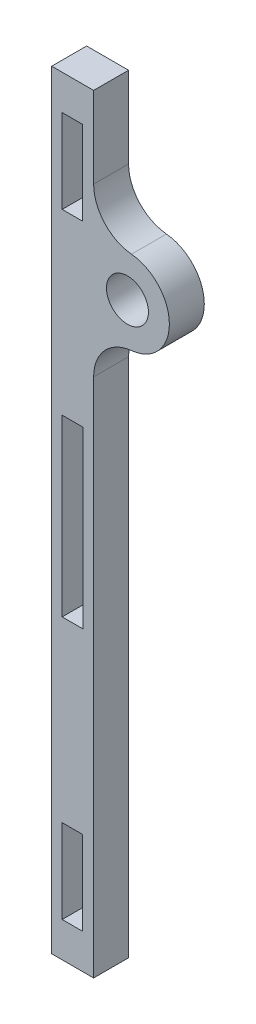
SolidWorks part; units mm, degrees
ref_plane "Ebene vorne" through (0, 0, 0) normal (0, 0, 1) x (1, 0, 0)
ref_plane "Ebene oben" through (0, 0, 0) normal (0, 1, 0) x (1, 0, 0)
ref_plane "Ebene rechts" through (0, 0, 0) normal (1, 0, 0) x (0, 0, -1)
sketch "Skizze1" plane through (0, 0, 0) normal (0, 0, 1) x (1, 0, 0)
  line L0 (-219.0998, -16.4582) -> (-219.0998, -90.9517)
  line L1 (-225.0998, 19.0483) -> (-219.0998, 19.0483)
  line L2 (-225.0998, 19.0483) -> (-225.0998, -90.9517)
  line L3 (-225.0998, -90.9517) -> (-219.0998, -90.9517)
  line L4 (-219.0998, 19.0483) -> (-219.0998, 7.4292)
  line L5 (-223.5998, 14.0483) -> (-220.6998, 14.0483)
  line L6 (-223.5998, 14.0483) -> (-223.5998, 2.0483)
  line L7 (-223.5998, 2.0483) -> (-220.6998, 2.0483)
  line L8 (-220.6998, 14.0483) -> (-220.6998, 2.0483)
  line L9 (-223.5998, -73.9517) -> (-220.6998, -73.9517)
  line L10 (-223.5998, -73.9517) -> (-223.5998, -85.9517)
  line L11 (-223.5998, -85.9517) -> (-220.6998, -85.9517)
  line L12 (-220.6998, -73.9517) -> (-220.6998, -85.9517)
  line L17 (-223.5998, -23.4517) -> (-223.5998, -48.4517)
  line L18 (-223.5998, -48.4517) -> (-220.5998, -48.4517)
  line L19 (-220.5998, -48.4517) -> (-220.5998, -23.4517)
  line L20 (-220.5998, -23.4517) -> (-223.5998, -23.4517)
  line L21 (-223.5998, -23.4517) -> (-223.5998, -48.4517)
  line L22 (-223.5998, -48.4517) -> (-220.5998, -48.4517)
  line L23 (-220.5998, -48.4517) -> (-220.5998, -23.4517)
  line L24 (-220.5998, -23.4517) -> (-223.5998, -23.4517)
  circle A0 centre (-214.2609, -4.5145) radius 3
  arc A1 (-213.6803, -10.4864) -> (-213.6803, 1.4573) centre (-214.2609, -4.5145) ccw
  circle A2 centre (-214.2609, -4.5145) radius 6 construction
  arc A3 (-213.6803, -10.4864) -> (-219.0998, -16.4582) centre (-213.0998, -16.4582) ccw
  arc A4 (-213.6803, 1.4573) -> (-219.0998, 7.4292) centre (-213.0998, 7.4292) cw
  point P16 (-214.2609, -4.5145)
  dimension "D9" = 6
  dimension "D10" = 6
  dimension "D1" = 110
  dimension "D2" = 6
  dimension "D3" = 12
  dimension "D4" = 2.9
  dimension "D5" = 1.5
  dimension "D6" = 100
  dimension "D7" = 5
  dimension "D8" = 3
  dimension "D11" = 0
extrude "Aufsatz-Linear austragen1" add sketch "Skizze1" along normal blind 5
